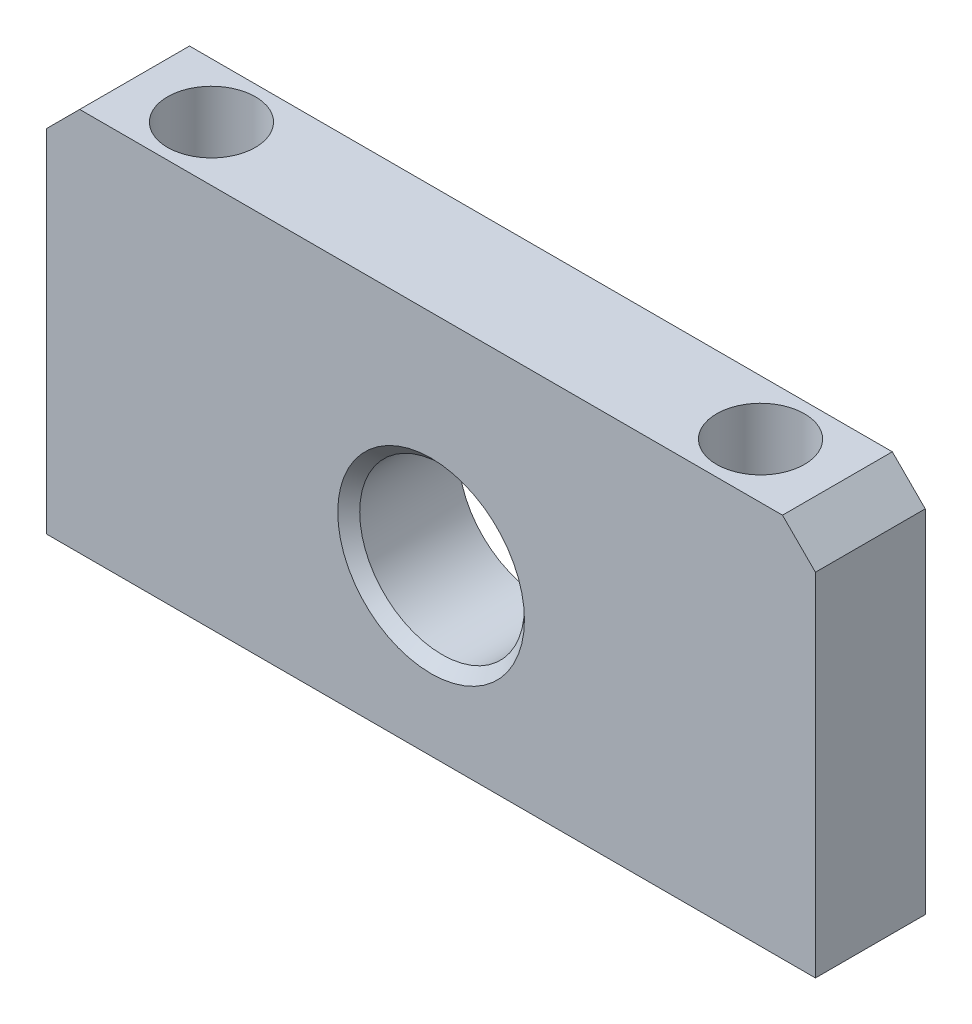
SolidWorks part; units mm, degrees
ref_plane "Face" through (0, 0, 0) normal (0, 0, 1) x (1, 0, 0)
ref_plane "Dessus" through (0, 0, 0) normal (0, 1, 0) x (1, 0, 0)
ref_plane "Droite" through (0, 0, 0) normal (1, 0, 0) x (0, 0, -1)
sketch "Esquisse1" plane through (0, 0, 0) normal (0, 0, 1) x (1, 0, 0)
  line L1 (0, 0) -> (70, 0)
  line L2 (0, 0) -> (0, 35)
  line L3 (0, 35) -> (70, 35)
  line L4 (70, 0) -> (70, 35)
  dimension "D1" = 70
  dimension "D2" = 35
extrude "Base-Extrusion" add sketch "Esquisse1" along normal blind 10
sketch "Esquisse2" plane through (0, 35, 0) normal (0, 1, 0) x (-1, 0, 0)
  line L0 (-70, 0) -> (-60, 0) construction
  line L1 (-70, 0) -> (0, 0) construction
  line L2 (-60, 0) -> (-60, 10) construction
  line L3 (-70, 10) -> (0, 10) construction
  line L4 (0, 0) -> (-10, 0) construction
  line L5 (-10, 0) -> (-10, 10) construction
  circle A0 centre (-60, 5) radius 4
  circle A1 centre (-10, 5) radius 4
  dimension "D2" = 8
  dimension "D1" = 50
extrude "Enlèv. mat.-Extru.1" cut sketch "Esquisse2" against normal blind 10
sketch "Esquisse3" plane through (0, 25, 0) normal (0, 1, 0) x (-1, 0, 0)
  circle A0 centre (-60, 5) radius 2.5
  circle A1 centre (-10, 5) radius 2.5
  circle A2 centre (-60, 5) radius 4 construction
  circle A3 centre (-10, 5) radius 4 construction
  dimension "D1" = 5
extrude "Enlèv. mat.-Extru.2" cut sketch "Esquisse3" against normal through all
chamfer "Chanfrein1" distance 3 angle 45
sketch "Esquisse4" plane through (0, 0, 10) normal (0, 0, 1) x (1, 0, 0)
  line L0 (35, 0) -> (35, 30) construction
  line L1 (0, 0) -> (70, 0) construction
  circle A0 centre (35, 15) radius 7.5
  dimension "D1" = 15
  dimension "D2" = 15
extrude "Enlèv. mat.-Extru.3" cut sketch "Esquisse4" against normal through all
chamfer "Chanfrein2" distance 1 angle 45
